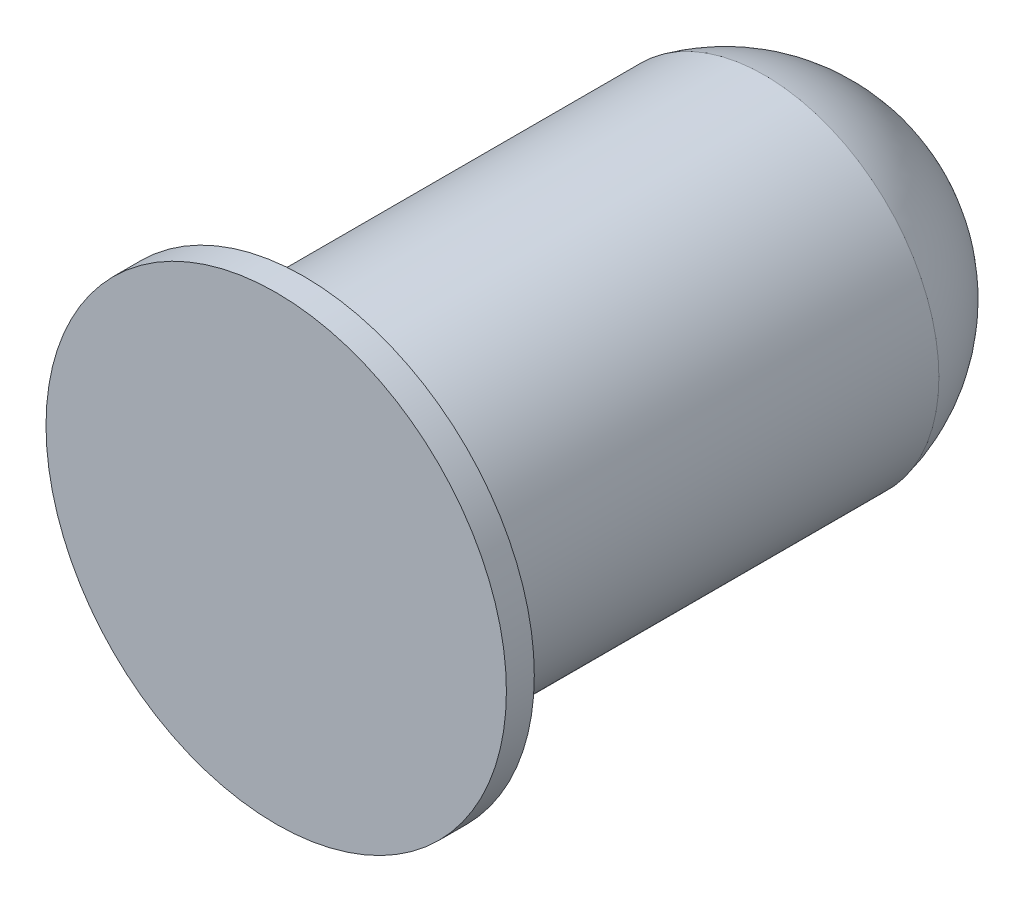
SolidWorks part; units mm, degrees
ref_plane "Plane1" through (0, 0, 0) normal (0, 0, 1) x (1, 0, 0)
ref_plane "Plane2" through (0, 0, 0) normal (0, 1, 0) x (1, 0, 0)
ref_plane "Plane3" through (0, 0, 0) normal (1, 0, 0) x (0, 0, -1)
sketch "Sketch1" plane through (0, 0, 0) normal (0, 0, 1) x (1, 0, 0)
  circle A0 centre (0, 0) radius 1.5875
  dimension "D1" = 3.175
extrude "Base-Extrude" add sketch "Sketch1" along normal blind 4.191
dome "Dome1" faces to dome 1 distance 1.27 parameters "D1"=1.27
sketch "Sketch2" plane through (0, 0, 4.191) normal (0, 0, 1) x (1, 0, 0)
  circle A1 centre (0, 0) radius 2.0955
  circle A2 centre (0, 0) radius 2.0955
  dimension "D1" = 0.508
extrude "Boss-Extrude1" add sketch "Sketch2" along normal blind 0.254
